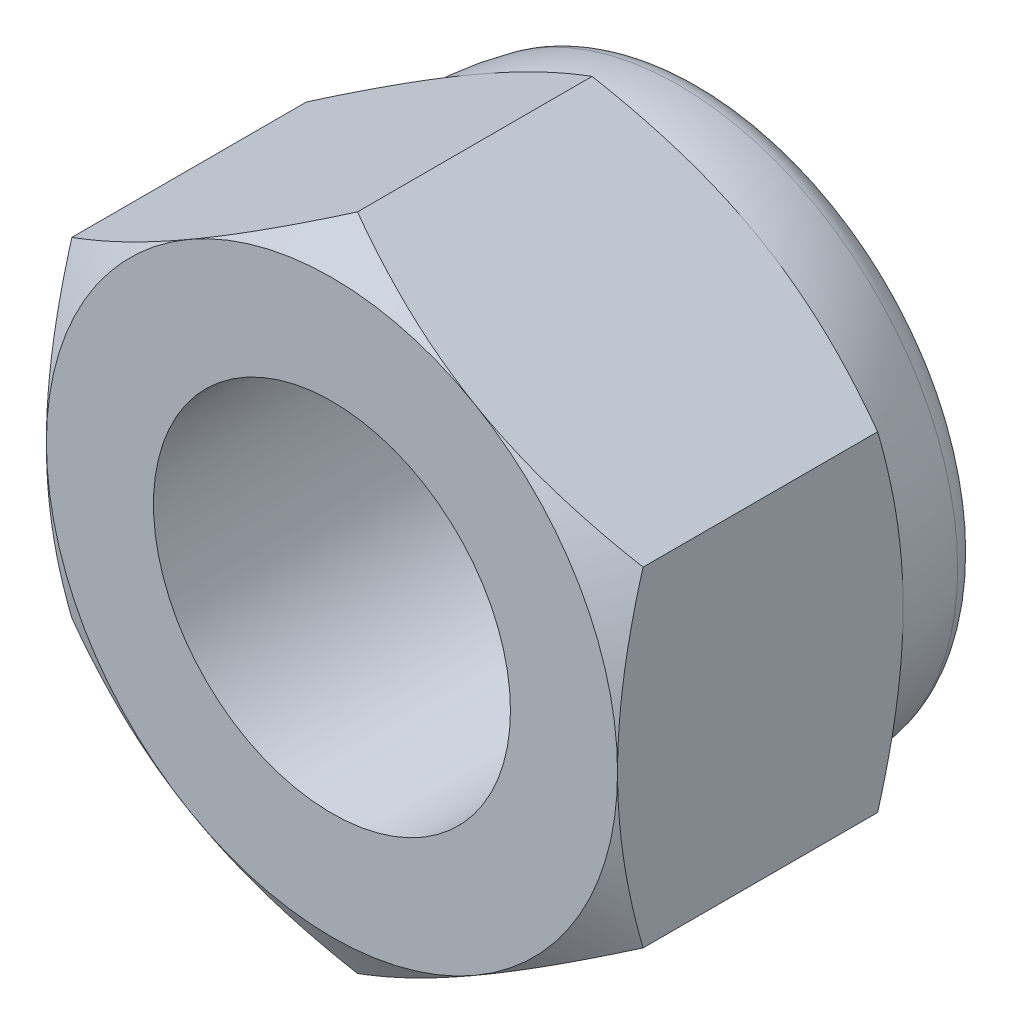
SolidWorks part; units mm, degrees
ref_plane "Plan1" through (0, 0, 0) normal (0, 0, 1) x (1, 0, 0)
ref_plane "Plan2" through (0, 0, 0) normal (0, 1, 0) x (1, 0, 0)
ref_plane "Plan3" through (0, 0, 0) normal (1, 0, 0) x (0, 0, -1)
sketch "Esquisse1" plane through (0, 0, 0) normal (0, 0, 1) x (1, 0, 0)
  line L0 (0, 0) -> (8, 0) construction
  line L1 (8, -4.6188) -> (8, 4.6188)
  line L2 (0, 0) -> (8, 4.6188) construction
  line L3 (0, 0) -> (0, 9.2376) construction
  line L4 (8, 4.6188) -> (0, 9.2376)
  line L5 (8, -4.6188) -> (0, -9.2376)
  line L6 (-8, -4.6188) -> (0, -9.2376)
  line L7 (-8, -4.6188) -> (-8, 4.6188)
  line L8 (-8, 4.6188) -> (0, 9.2376)
  circle A0 centre (0, 0) radius 8 construction
  circle A1 centre (0, 0) radius 9.2376 construction
  dimension "D2" = 16
  dimension "D1" = 30
extrude "Base-Extrusion" add sketch "Esquisse1" against normal blind 8
sketch "Esquisse2" plane through (0, 0, 0) normal (0, 1, 0) x (1, 0, 0)
  line L0 (-8, 0) -> (-15.9282, 0)
  line L1 (0, 8) -> (0, 0) construction
  line L2 (-8, 8) -> (-15.9282, 8)
  line L3 (-15.9282, 8) -> (-15.9282, 0)
  line L5 (-14.9282, 4) -> (-8, 8)
  line L6 (0, 8) -> (0, 0) construction
  line L7 (-8, 0) -> (-14.9282, 4)
  dimension "D1" = 30
  dimension "D2" = 1
  dimension "D3" = 30
revolve "Enlèvement de matière-Révolution1" cut sketch "Esquisse2" angle 360 about L6
sketch "Esquisse4" plane through (0, 0, 0) normal (0, 1, 0) x (1, 0, 0)
  line L0 (0, 0) -> (0, 16) construction
  line L2 (0, 16) -> (0, 8)
  line L3 (0, 8) -> (-8, 8)
  arc A0 (0, 16) -> (-8, 8) centre (0, 8) ccw
  dimension "D1" = 16
revolve "Boss.-Révol.1" add sketch "Esquisse4" angle 360 about L0
ref_plane "Plan4" through (0, 0, -10.5) normal (0, 0, 1) x (1, 0, 0)
sketch "Esquisse5" plane through (0, 0, -10.5) normal (0, 0, 1) x (1, 0, 0)
  arc A6 (8, 0) -> (4, 6.9282) centre (0, 0) ccw
  arc A7 (4, -6.9282) -> (8, 0) centre (0, 0) ccw
  arc A8 (-4, -6.9282) -> (4, -6.9282) centre (0, 0) ccw
  arc A9 (-8, 0) -> (-4, -6.9282) centre (0, 0) ccw
  arc A10 (-4, 6.9282) -> (-8, 0) centre (0, 0) ccw
  arc A11 (4, 6.9282) -> (-4, 6.9282) centre (0, 0) ccw
  arc A12 (8, 0) -> (4, 6.9282) centre (0, 0) ccw
  arc A13 (4, -6.9282) -> (8, 0) centre (0, 0) ccw
  arc A14 (-4, -6.9282) -> (4, -6.9282) centre (0, 0) ccw
  arc A15 (-8, 0) -> (-4, -6.9282) centre (0, 0) ccw
  arc A16 (-4, 6.9282) -> (-8, 0) centre (0, 0) ccw
  arc A17 (4, 6.9282) -> (-4, 6.9282) centre (0, 0) ccw
  dimension "D1" = 0
extrude "Enlèv. mat.-Extru.2" cut sketch "Esquisse5" against normal through all
fillet "Congé1" radius 1 1 edges at (7.5993, 0, -10.5)
sketch "Esquisse3" plane through (0, 0, 0) normal (0, 0, 1) x (1, 0, 0)
  circle A0 centre (0, 0) radius 5
  dimension "D1" = 10
extrude "Enlèv. mat.-Extru.1" cut sketch "Esquisse3" against normal through all
ref_axis "Axe1" through (0, 0, -50) along (0, 0, 1)
sketch "Esquisse6" plane through (0, 0, 0) normal (0, 1, 0) x (1, 0, 0)
  line L0 (5, 0) -> (5, 10.5) construction
  line L1 (5, 10.6) -> (4.3, 10.6)
  line L2 (5, 10.6) -> (5, 9.1)
  line L3 (5, 9.1) -> (4.3, 9.1)
  line L4 (4.3, 10.6) -> (4.3, 9.1)
  line L7 (5, 10.5) -> (-5, 10.5) construction
  dimension "D1" = 1.5
  dimension "D2" = 0.7
  dimension "D3" = 0.1
revolve "Révolution2" add sketch "Esquisse6" angle 360 about axis through (0, 0, -50) along (0, 0, 1)
